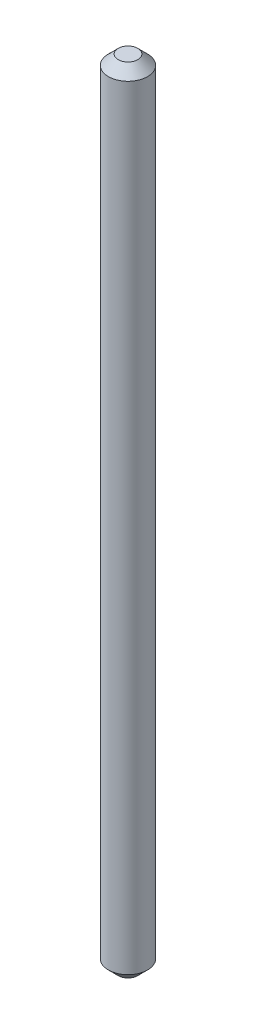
SolidWorks part; units mm, degrees
ref_plane "Front Plane" through (0, 0, 0) normal (0, 0, 1) x (1, 0, 0)
ref_plane "Top Plane" through (0, 0, 0) normal (0, 1, 0) x (1, 0, 0)
ref_plane "Right Plane" through (0, 0, 0) normal (1, 0, 0) x (0, 0, -1)
sketch "Sketch1" plane through (0, 0, 0) normal (0, 1, 0) x (1, 0, 0)
  circle A0 centre (0, 0) radius 2
  dimension "D1" = 4
extrude "Extrude1" add sketch "Sketch1" along normal blind 81
chamfer "Chamfer1" distance 1 angle 45 2 edges at (0, 0, 2) (0, 81, 2)
